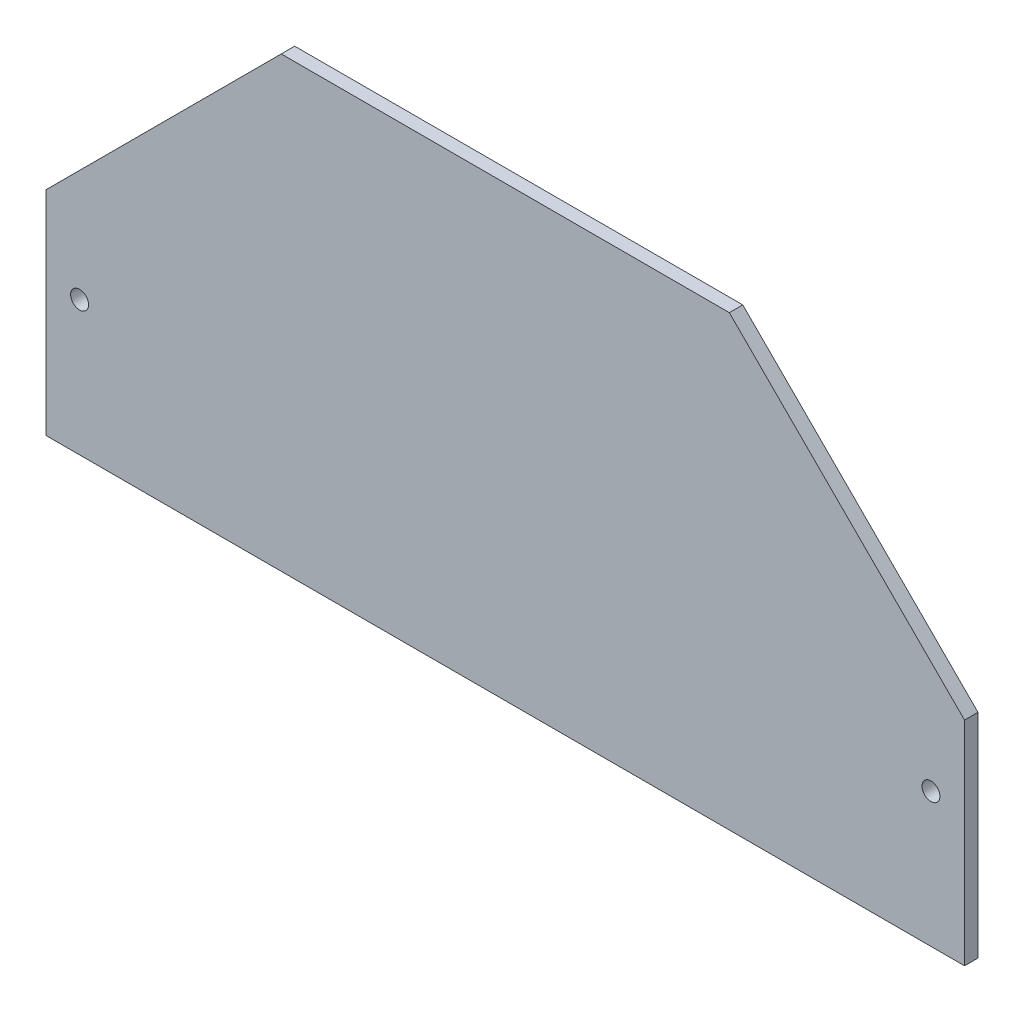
SolidWorks part; units mm, degrees
ref_plane "Front Plane" through (0, 0, 0) normal (0, 0, 1) x (1, 0, 0)
ref_plane "Top Plane" through (0, 0, 0) normal (0, 1, 0) x (1, 0, 0)
ref_plane "Right Plane" through (0, 0, 0) normal (1, 0, 0) x (0, 0, -1)
sketch "Sketch1" plane through (0, 0, 0) normal (0, 0, 1) x (1, 0, 0)
  line L0 (0, 0) -> (0, -100) construction
  line L1 (-512.5, -250) -> (512.5, -250)
  line L2 (-512.5, -250) -> (-512.5, 250)
  line L3 (-512.5, 250) -> (512.5, 250)
  line L4 (512.5, -250) -> (512.5, 250)
  line L5 (-512.5, -250) -> (512.5, 250) construction
  line L6 (-512.5, 250) -> (512.5, -250) construction
  line L7 (-475, -100) -> (475, -100) construction
  circle A0 centre (-475, -100) radius 10
  circle A1 centre (475, -100) radius 10
  point P0 (0, 0)
  point P11 (0, -100)
  dimension "D5" = 20
  dimension "D6" = 20
  dimension "D1" = 1025
  dimension "D2" = 500
  dimension "D3" = 100
  dimension "D4" = 950
extrude "Boss-Extrude1" add sketch "Sketch1" along normal blind 15
sketch "Sketch2" plane through (0, 0, 0) normal (0, 0, 1) x (1, 0, 0)
  line L0 (-512.5, -250) -> (-512.5, -12.5)
  line L1 (-512.5, 250) -> (-512.5, -250) construction
  line L2 (-512.5, -12.5) -> (-250, 250)
  line L3 (512.5, 250) -> (-512.5, 250) construction
  line L4 (-250, 250) -> (250, 250)
  line L5 (250, 250) -> (512.5, -12.5)
  line L6 (512.5, -250) -> (512.5, 250) construction
  line L7 (512.5, -12.5) -> (512.5, -250)
  line L8 (512.5, -250) -> (-512.5, -250)
  point P5 (0, 250)
  point P15 (0, -250)
  dimension "D1" = 500
  dimension "D2" = 135
extrude "Cut-Extrude1" cut sketch "Sketch2" along normal through all flip side to cut
